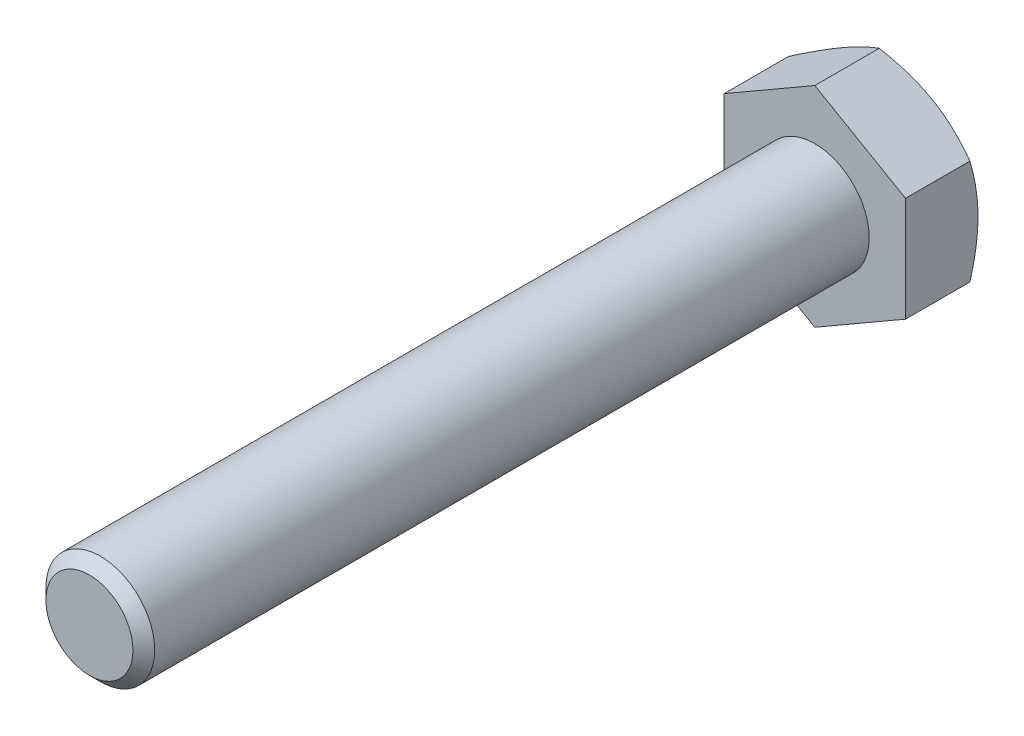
SolidWorks part; units mm, degrees
ref_plane "Plan1" through (0, 0, 0) normal (0, 0, 1) x (1, 0, 0)
ref_plane "Plan2" through (0, 0, 0) normal (0, 1, 0) x (1, 0, 0)
ref_plane "Plan3" through (0, 0, 0) normal (1, 0, 0) x (0, 0, -1)
sketch "Esquisse1" plane through (0, 0, 0) normal (0, 1, 0) x (1, 0, 0)
  line L1 (0, 0) -> (0, -40) construction
  line L2 (0, 0) -> (3, 0)
  line L3 (0, 0) -> (0, -40)
  line L4 (0, -40) -> (3, -40)
  line L6 (3, 0) -> (3, -40)
  dimension "D1" = 40
  dimension "D2" = 3
revolve "Base-Révolution" add sketch "Esquisse1" angle 360 about L1
chamfer "Chanfrein1" distance 0.6 angle 45
sketch "Esquisse3" plane through (0, 0, 0) normal (0, 1, 0) x (1, 0, 0)
  line L0 (3, -39.4) -> (3, 0) construction
  line L1 (-2.4, -40) -> (2.4, -40) construction
  line L2 (2.4, -40) -> (2.4, -39.94)
  line L3 (2.4, -39.94) -> (3.06, -39.5589)
  line L4 (2.4, -40) -> (2.4, -40.06)
  line L5 (2.4, -40.06) -> (3.06, -40.4411)
  line L6 (3.06, -39.5589) -> (3.06, -40.4411)
  point P0 (10, -20)
  point P1 (3, -40)
  dimension "D1" = 0.6
  dimension "D2" = 0.06
  dimension "D3" = 0.66
  dimension "D4" = 0.06
  dimension "D5" = 60
  dimension "D6" = 60
sketch "Esquisse4" plane through (0, 0, 40) normal (0, 0, 1) x (1, 0, 0)
  circle A0 centre (0, 0) radius 3 construction
  circle A1 centre (0, 0) radius 3
sketch "Esquisse6" plane through (0, 0, 0) normal (0, 0, 1) x (1, 0, 0)
  line L0 (0, 0) -> (5, 0) construction
  line L1 (5, -2.8868) -> (5, 2.8868)
  line L2 (0, 0) -> (5, 2.8868) construction
  line L3 (0, 5.7735) -> (5, 2.8868)
  line L4 (0, -5.7735) -> (5, -2.8868)
  line L5 (0, 0) -> (0, 5) construction
  line L6 (-5, -2.8868) -> (-5, 2.8868)
  line L7 (-5, 2.8868) -> (0, 5.7735)
  line L8 (0, -5.7735) -> (-5, -2.8868)
  circle A0 centre (0, 0) radius 5 construction
  dimension "D2" = 30
  dimension "D1" = 10
extrude "Boss.-Extru.1" add sketch "Esquisse6" against normal blind 4
sketch "Esquisse7" plane through (0, 0, 0) normal (0, 1, 0) x (1, 0, 0)
  line L0 (-5, 4) -> (-11.9282, 4)
  line L1 (-5, 4) -> (-11.9282, 0)
  line L2 (-11.9282, 4) -> (-11.9282, 0)
  line L3 (0, 6.2394) -> (0, 0) construction
  line L4 (0, -39.4) -> (0, -40) construction
  dimension "D1" = 30
revolve "Enlèvement de matière-Révolution1" cut sketch "Esquisse7" angle 360 about L3
